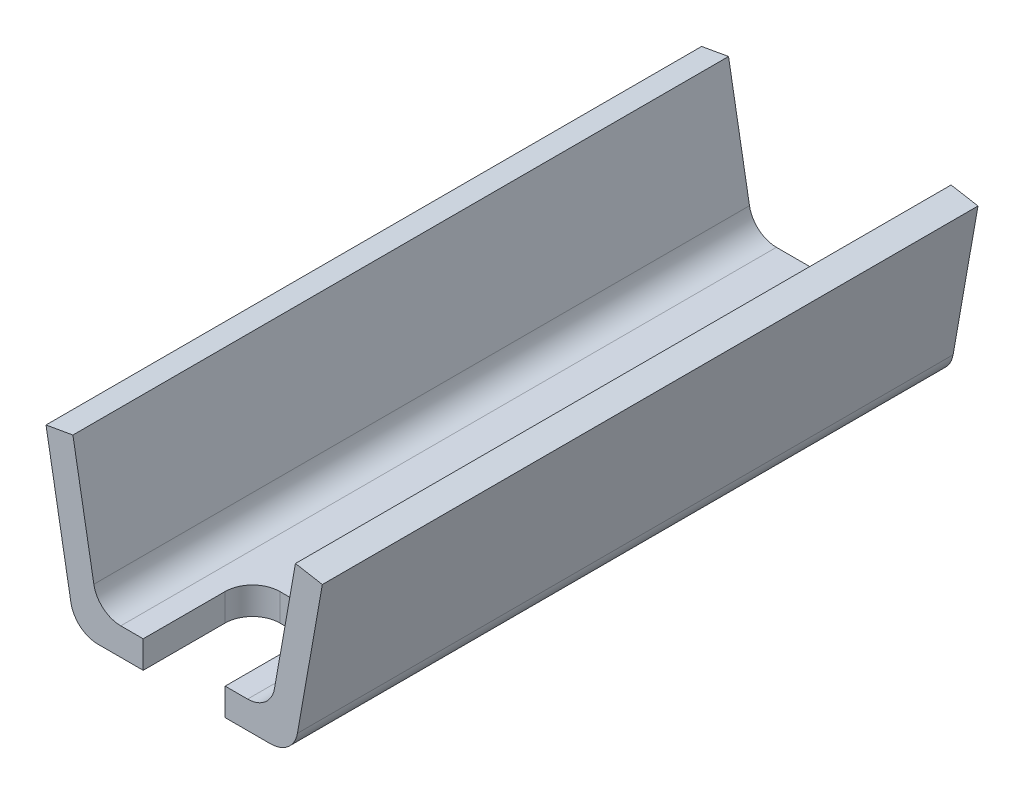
SolidWorks part; units mm, degrees
ref_plane "前视基准面" through (0, 0, 0) normal (0, 0, 1) x (1, 0, 0)
ref_plane "上视基准面" through (0, 0, 0) normal (0, 1, 0) x (1, 0, 0)
ref_plane "右视基准面" through (0, 0, 0) normal (1, 0, 0) x (0, 0, -1)
sketch "草图1" plane through (0, 0, 0) normal (0, 0, 1) x (1, 0, 0)
  line L0 (-15.8045, 0) -> (15.8045, 0)
  line L1 (20.7285, 4.1318) -> (25.2898, 30)
  line L2 (25.2898, 30) -> (20.3658, 30.8682)
  line L3 (20.3658, 30.8682) -> (16.533, 9.1318)
  line L4 (11.609, 5) -> (-11.609, 5)
  line L5 (-16.533, 9.1318) -> (-20.3658, 30.8682)
  line L6 (-20.7285, 4.1318) -> (-25.2898, 30)
  line L7 (-25.2898, 30) -> (-20.3658, 30.8682)
  arc A0 (-11.609, 5) -> (-16.533, 9.1318) centre (-11.609, 10) cw
  arc A1 (11.609, 5) -> (16.533, 9.1318) centre (11.609, 10) ccw
  arc A2 (15.8045, 0) -> (20.7285, 4.1318) centre (15.8045, 5) ccw
  arc A3 (-15.8045, 0) -> (-20.7285, 4.1318) centre (-15.8045, 5) cw
  point P15 (20, 0)
  point P18 (-20, 0)
  dimension "D10" = 5
  dimension "D1" = 5
  dimension "D2" = 5
  dimension "D3" = 5
  dimension "D4" = 40
  dimension "D5" = 20
  dimension "D6" = 100
  dimension "D7" = 100
  dimension "D8" = 30
  dimension "D9" = 30
extrude "拉伸1" add sketch "草图1" along normal blind 120
sketch "草图2" plane through (0, 0, 0) normal (0, -1, 0) x (1, 0, 0)
  line L0 (0, 81.8258) -> (0, 0) construction
  line L1 (-7.5, 120) -> (7.5, 120)
  line L2 (-15.8045, 120) -> (15.8045, 120) construction
  line L3 (7.5, 120) -> (7.5, 105)
  line L4 (2.5, 100) -> (-2.5, 100)
  line L5 (-7.5, 105) -> (-7.5, 120)
  arc A0 (-2.5, 100) -> (-7.5, 105) centre (-2.5, 105) cw
  arc A1 (7.5, 105) -> (2.5, 100) centre (2.5, 105) cw
  point P11 (-7.5, 100)
  point P14 (7.5, 100)
  dimension "D4" = 5
  dimension "D1" = 15
  dimension "D2" = 20
  dimension "D3" = 7.5
extrude "切除-拉伸1" cut sketch "草图2" against normal through all
